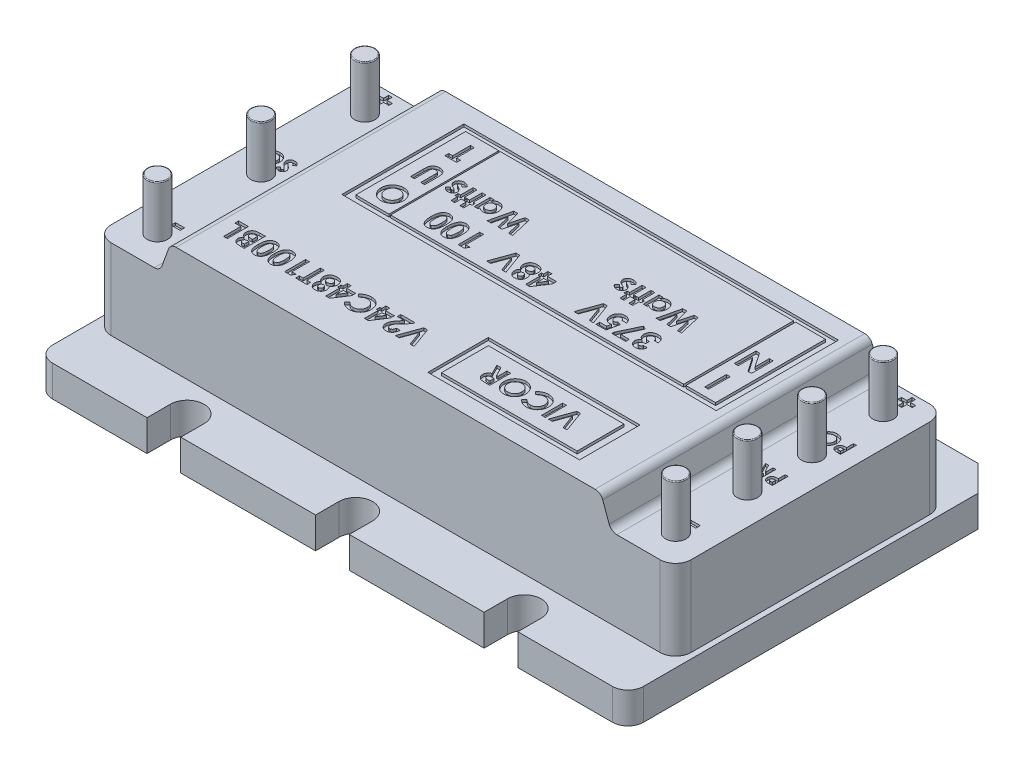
SolidWorks part; units mm, degrees
ref_plane "Front" through (0, 0, 0) normal (0, 0, 1) x (1, 0, 0)
ref_plane "Top" through (0, 0, 0) normal (0, 1, 0) x (1, 0, 0)
ref_plane "Right" through (0, 0, 0) normal (1, 0, 0) x (0, 0, -1)
sketch "Sketch1" plane through (0, 0, 0) normal (0, 1, 0) x (1, 0, 0)
  line L1 (1.524, 0) -> (56.388, 0)
  line L2 (0, 1.524) -> (0, 35.306)
  line L3 (1.524, 36.83) -> (57.912, 36.83)
  line L4 (57.912, 1.524) -> (57.912, 36.83)
  arc A0 (1.524, 0) -> (0, 1.524) centre (1.524, 1.524) cw
  arc A1 (0, 35.306) -> (1.524, 36.83) centre (1.524, 35.306) cw
  arc A2 (56.388, 0) -> (57.912, 1.524) centre (56.388, 1.524) ccw
  point P7 (0, 0)
  point P10 (0, 36.83)
  point P13 (57.912, 0)
  dimension "D3" = 1.524
  dimension "D1" = 36.83
  dimension "D2" = 57.912
extrude "Extrude1" add sketch "Sketch1" along normal blind 3.048
chamfer "Chamfer1" distance 2.54 angle 45 1 edges at (57.912, 1.524, -36.83)
sketch "Sketch2" plane through (0, 3.048, 0) normal (0, 1, 0) x (-1, 0, 0)
  line L0 (0, -18.415) -> (-57.912, -18.415) construction
  line L3 (0, -35.306) -> (0, -1.524) construction
  line L4 (-55.8448, -5.207) -> (-2.0672, -5.207)
  line L5 (-57.3688, -6.731) -> (-57.3688, -30.099)
  line L6 (-55.8448, -31.623) -> (-2.0672, -31.623)
  line L8 (-57.912, -1.524) -> (-57.912, -34.29) construction
  line L9 (-28.956, 0) -> (-28.956, 3.7439) construction
  line L10 (-1.524, 0) -> (-56.388, 0) construction
  line L11 (-0.5432, -6.731) -> (-0.5432, -30.099)
  arc A0 (-0.5432, -6.731) -> (-2.0672, -5.207) centre (-2.0672, -6.731) ccw
  arc A1 (-0.5432, -30.099) -> (-2.0672, -31.623) centre (-2.0672, -30.099) cw
  arc A2 (-57.3688, -30.099) -> (-55.8448, -31.623) centre (-55.8448, -30.099) ccw
  arc A3 (-55.8448, -5.207) -> (-57.3688, -6.731) centre (-55.8448, -6.731) ccw
  point P16 (-0.5432, -5.207)
  point P19 (-0.5432, -31.623)
  point P22 (-57.3688, -31.623)
  point P25 (-57.3688, -5.207)
  dimension "D3" = 1.524
  dimension "D1" = 13.208
  dimension "D2" = 13.208
extrude "Extrude2" add sketch "Sketch2" along normal blind 10.668
sketch "Sketch3" plane through (0, 0, -31.623) normal (0, 0, -1) x (-1, 0, 0)
  line L0 (-58.913, 10.922) -> (-51.054, 10.922)
  line L1 (-55.372, 0) -> (-1.524, 0) construction
  line L4 (-6.858, 10.922) -> (1.7731, 10.922)
  line L8 (-6.858, 10.922) -> (-8.4988, 15.4302)
  line L9 (-51.054, 10.922) -> (-49.4132, 15.4302)
  line L10 (-8.4988, 15.4302) -> (1.7731, 15.4302)
  line L11 (1.7731, 15.4302) -> (1.7731, 10.922)
  line L12 (-49.4132, 15.4302) -> (-58.913, 15.4302)
  line L13 (-58.913, 15.4302) -> (-58.913, 10.922)
  dimension "D1" = 10.922
extrude "Cut-Extrude1" cut sketch "Sketch3" against normal through all
fillet "Fillet1" radius 0.7937 4 edges at (6.858, 10.922, -18.415) (7.8749, 13.716, -18.415) (50.0371, 13.716, -18.415) (51.054, 10.922, -18.415)
sketch "Sketch5" plane through (0, 0, 0) normal (0, -1, 0) x (1, 0, 0)
  line L0 (28.956, -2.286) -> (28.956, -34.544) construction
  line L1 (14.097, -37.2993) -> (14.097, -34.544)
  line L2 (0, -18.415) -> (57.912, -18.415) construction
  line L3 (0, -35.306) -> (0, -1.524) construction
  line L4 (57.912, -1.524) -> (57.912, -34.29) construction
  line L5 (30.607, -37.2993) -> (30.607, -34.544)
  line L6 (47.117, -37.2993) -> (47.117, -34.544)
  line L7 (45.466, 3.9664) -> (45.466, -34.544) construction
  line L8 (43.815, -37.2993) -> (43.815, -34.544)
  line L9 (27.305, -37.2993) -> (27.305, -34.544)
  line L10 (43.815, -37.2993) -> (47.117, -37.2993)
  line L11 (10.795, -37.2993) -> (10.795, -34.544)
  line L12 (12.446, 9.4619) -> (12.446, -34.544) construction
  line L13 (10.795, -37.2993) -> (14.097, -37.2993)
  line L14 (27.305, 0.4693) -> (30.607, 0.4693)
  line L15 (10.795, 0.4693) -> (14.097, 0.4693)
  line L16 (10.795, 0.4693) -> (10.795, -2.286)
  line L17 (43.815, 0.4693) -> (47.117, 0.4693)
  line L18 (27.305, 0.4693) -> (27.305, -2.286)
  line L19 (43.815, 0.4693) -> (43.815, -2.286)
  line L20 (47.117, 0.4693) -> (47.117, -2.286)
  line L21 (30.607, 0.4693) -> (30.607, -2.286)
  line L22 (14.097, 0.4693) -> (14.097, -2.286)
  line L24 (27.305, -37.2993) -> (30.607, -37.2993)
  arc A0 (30.607, -34.544) -> (27.305, -34.544) centre (28.956, -34.544) ccw
  arc A1 (47.117, -34.544) -> (43.815, -34.544) centre (45.466, -34.544) ccw
  arc A2 (14.097, -34.544) -> (10.795, -34.544) centre (12.446, -34.544) ccw
  arc A3 (14.097, -2.286) -> (10.795, -2.286) centre (12.446, -2.286) cw
  arc A4 (47.117, -2.286) -> (43.815, -2.286) centre (45.466, -2.286) cw
  arc A5 (30.607, -2.286) -> (27.305, -2.286) centre (28.956, -2.286) cw
  dimension "D3" = 16.51
  dimension "D4" = 16.51
extrude "Cut-Extrude2" cut sketch "Sketch5" against normal through all
sketch "Sketch6" plane through (0, 10.922, 0) normal (0, 1, 0) x (-1, 0, 0)
  line L0 (-54.356, 4.0527) -> (-54.356, -40.1879) construction
  line L1 (-3.556, 4.0527) -> (-3.556, -40.8827) construction
  line L2 (-3.556, -18.415) -> (-54.356, -18.415) construction
  line L3 (-43.3733, -21.59) -> (-54.356, -21.59) construction
  line L5 (-54.356, -8.255) -> (-3.556, -8.255) construction
  line L6 (-54.356, -28.575) -> (-3.556, -28.575) construction
  arc A0 (-27.305, -34.544) -> (-30.607, -34.544) centre (-28.956, -34.544) ccw construction
  circle A1 centre (-3.556, -8.255) radius 1.0033
  circle A2 centre (-3.556, -18.415) radius 1.0033
  circle A3 centre (-3.556, -28.575) radius 1.0033
  circle A4 centre (-54.356, -28.5644) radius 1.0033
  circle A5 centre (-54.356, -8.2444) radius 1.0033
  circle A6 centre (-54.356, -21.5794) radius 1.0033
  circle A7 centre (-54.356, -15.2506) radius 1.0033
  dimension "D1" = 25.4
  dimension "D2" = 25.4
  dimension "D5" = 2.0066
  dimension "D3" = 10.16
  dimension "D4" = 10.16
  dimension "D6" = 6.985
extrude "Extrude3" add sketch "Sketch6" along normal blind 5.08
fillet "Fillet2" radius 0.0794 7 edges at (54.356, 16.002, -27.5611) (54.356, 16.002, -20.5761) (54.356, 16.002, -16.2539) (54.356, 16.002, -7.2411) (3.556, 16.002, -7.2517) (3.556, 16.002, -17.4117) (3.556, 16.002, -27.5717)
sketch "Sketch7"
extrude "Cut-Extrude3" cut sketch "Sketch7" against normal blind 0.254
sketch "Sketch8" plane through (0, 13.716, 0) normal (0, 1, 0) x (-1, 0, 0)
  line L1 (-45.3601, -12.1572) -> (-32.0706, -12.1572)
  line L2 (-45.3601, -12.1572) -> (-45.3601, -7.5703)
  line L3 (-45.3601, -7.5703) -> (-32.0706, -7.5703)
  line L4 (-32.0706, -12.1572) -> (-32.0706, -7.5703)
  line L5 (-46.2306, -12.8539) -> (-31.3742, -12.8539)
  line L6 (-46.2306, -12.8539) -> (-46.2306, -6.9317)
  line L7 (-46.2306, -6.9317) -> (-31.3742, -6.9317)
  line L8 (-31.3742, -12.8539) -> (-31.3742, -6.9317)
extrude "Cut-Extrude4" cut sketch "Sketch8" against normal blind 0.254
sketch "Sketch9"
extrude "Cut-Extrude5" cut sketch "Sketch9" against normal blind 0.254
sketch "Sketch10"
extrude "Cut-Extrude6" cut sketch "Sketch10" against normal blind 0.254
sketch "Sketch13" plane through (0, 13.716, 0) normal (0, 1, 0) x (-1, 0, 0)
  line L0 (-16.0449, -18.4573) -> (-16.0449, -29.2145)
  line L1 (-48.036, -18.4573) -> (-45.1251, -18.4573)
  line L2 (-48.036, -18.4573) -> (-48.036, -29.2145)
  line L3 (-48.036, -29.2145) -> (-45.1251, -29.2145)
  line L4 (-12.7885, -18.4573) -> (-12.7885, -29.2145)
  line L5 (-48.751, -17.8117) -> (-12.0665, -17.8117)
  line L6 (-48.751, -17.8117) -> (-48.751, -29.7767)
  line L7 (-48.751, -29.7767) -> (-12.0665, -29.7767)
  line L8 (-12.0665, -17.8117) -> (-12.0665, -29.7767)
  line L9 (-45.1251, -18.4573) -> (-45.1251, -29.2145)
  line L10 (-44.9087, -18.4573) -> (-44.9087, -29.2145)
  line L11 (-16.1948, -18.4573) -> (-16.1948, -29.2145)
  line L12 (-16.0449, -18.4573) -> (-12.7885, -18.4573)
  line L13 (-16.0449, -29.2145) -> (-12.7885, -29.2145)
  line L14 (-44.9087, -29.2145) -> (-16.1948, -29.2145)
  line L15 (-44.9087, -18.4573) -> (-16.1948, -18.4573)
extrude "Cut-Extrude7" cut sketch "Sketch13" against normal blind 0.254
sketch "Sketch14"
extrude "Cut-Extrude8" cut sketch "Sketch14" against normal blind 0.254
